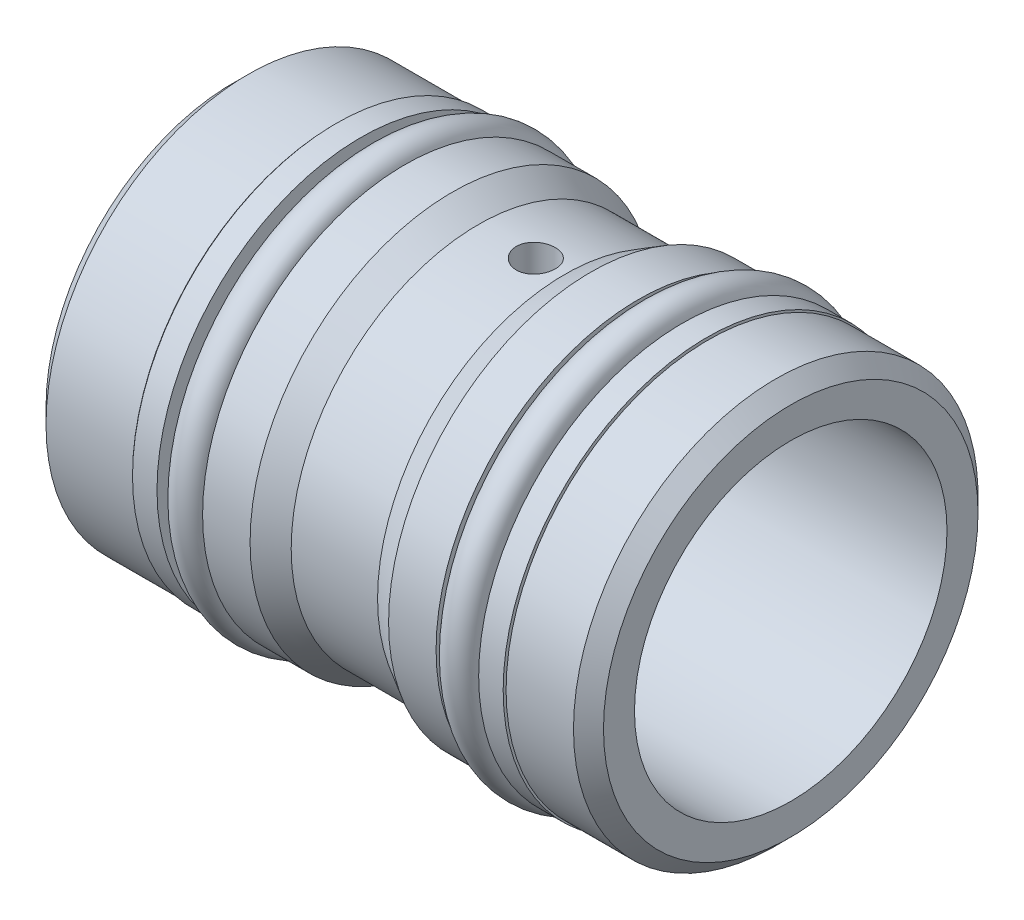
SolidWorks part; units mm, degrees
ref_plane "Front Plane" through (0, 0, 0) normal (0, 0, 1) x (1, 0, 0)
ref_plane "Top Plane" through (0, 0, 0) normal (0, 1, 0) x (1, 0, 0)
ref_plane "Right Plane" through (0, 0, 0) normal (1, 0, 0) x (0, 0, -1)
sketch "Sketch1" plane through (0, 0, 0) normal (0, 0, 1) x (1, 0, 0)
  line L0 (0, 0) -> (0, 45.5562) construction
  line L1 (0, 0) -> (32.8567, 0) construction
  line L2 (-14.16, 4.7625) -> (-14.16, 10.2743)
  line L3 (-14.16, 10.2743) -> (-9, 10.2743)
  line L4 (-9, 10.2743) -> (-9, 9.0043)
  line L5 (-9, 9.0043) -> (-5.444, 9.0043)
  line L6 (-5.444, 9.0043) -> (-5.444, 10.2743)
  line L7 (-5.444, 10.2743) -> (-3.031, 10.2743)
  line L8 (-3.031, 10.2743) -> (-3.031, 9.51)
  line L9 (-3.031, 9.51) -> (4.0048, 9.51)
  line L10 (-14.16, 4.7625) -> (0.0884, 4.7625)
  line L11 (0.0884, 4.7625) -> (0.0884, 7.9375)
  line L12 (0.0884, 7.9375) -> (14.16, 7.9375)
  line L13 (4.0048, 10.2743) -> (4.0048, 9.51)
  line L14 (6.4178, 10.2743) -> (4.0048, 10.2743)
  line L15 (6.4178, 9.0043) -> (6.4178, 10.2743)
  line L16 (9.9738, 9.0043) -> (6.4178, 9.0043)
  line L17 (9.9738, 10.2743) -> (9.9738, 9.0043)
  line L18 (14.16, 10.2743) -> (9.9738, 10.2743)
  line L19 (14.16, 10.2743) -> (14.16, 7.9375)
  dimension "D2" = 3.556
  dimension "D3" = 7.0358
  dimension "D4" = 20.5486
  dimension "D5" = 28.32
  dimension "D6" = 15.875
  dimension "D7" = 14.0716
  dimension "D8" = 19.02
  dimension "D9" = 18.0086
  dimension "D10" = 9.525
  dimension "D11" = 23.16
  dimension "D12" = 2.413
  dimension "D13" = 2.413
revolve "Revolve1" add sketch "Sketch1" angle 360 about L1
fillet "Fillet1" radius 0.381 2 edges at (4.0048, 0, 9.51) (-3.031, 0, 9.51)
chamfer "Chamfer1" distance 0.762 angle 45 2 edges at (14.16, 0, 10.2743) (-14.16, 0, 10.2743)
sketch "Sketch6" plane through (0, 0, 0) normal (0, 0, 1) x (1, 0, 0)
  line L0 (0, 0) -> (49.5791, 0) construction
  line L1 (-14.16, 9.5123) -> (-14.16, -9.5123) construction
  line L2 (-5.444, 9.0043) -> (-9, 9.0043) construction
  line L3 (-8.9276, 9.0043) -> (-7.683, 9.0043)
  line L4 (-8.9276, 9.0043) -> (-8.9276, 10.3505)
  line L5 (-8.9276, 10.3505) -> (-7.683, 10.3505)
  line L6 (-7.683, 9.0043) -> (-7.683, 10.3505)
  line L7 (0.4869, 41.4439) -> (0.4869, -9.3524) construction
  line L8 (-9, -10.2743) -> (-9, 10.2743) construction
  line L9 (9.9738, 9.0043) -> (9.9738, -9.0043) construction
  line L10 (-5.444, 10.2743) -> (-5.444, -10.2743) construction
  line L11 (8.6568, 9.0043) -> (8.6568, 10.3505)
  line L12 (9.9014, 10.3505) -> (8.6568, 10.3505)
  line L13 (9.9014, 9.0043) -> (9.9014, 10.3505)
  line L14 (9.9014, 9.0043) -> (8.6568, 9.0043)
  circle A0 centre (-6.4092, 9.8171) radius 0.889
  circle A1 centre (7.383, 9.8171) radius 0.889
  dimension "D4" = 1.778
  dimension "D5" = 19.6342
  dimension "D6" = 0.9652
  dimension "D1" = 1.2446
  dimension "D2" = 5.2324
  dimension "D3" = 20.701
revolve "Revolve3" add sketch "Sketch6" angle 360 about L0
sketch "Sketch7" plane through (0, 0, 0) normal (0, 1, 0) x (0, 0, -1)
  line L1 (-9.5123, -14.16) -> (9.5123, -14.16) construction
  circle A0 centre (0, -1.21) radius 0.9906
  dimension "D1" = 1.9812
  dimension "D2" = 12.95
extrude "Cut-Extrude1" cut sketch "Sketch7" against normal through all and the other way through all
sketch "Sketch8" plane through (0, 0, 0) normal (0, 0, 1) x (1, 0, 0)
  line L0 (0, 0) -> (15.6047, 0) construction
  line L1 (-3.031, 10.2743) -> (-1.7072, 9.51)
  line L2 (0.2194, 9.51) -> (-2.65, 9.51) construction
  line L3 (-1.7072, 9.51) -> (-3.031, 9.51)
  line L4 (-3.031, -10.2743) -> (-3.031, 10.2743) construction
  line L5 (-3.031, 9.51) -> (-3.031, 10.2743)
  line L6 (4.0048, 10.2743) -> (2.681, 9.51)
  line L7 (4.0048, 10.2743) -> (4.0048, -10.2743) construction
  line L8 (3.6238, 9.51) -> (2.2006, 9.51) construction
  line L9 (2.681, 9.51) -> (4.0048, 9.51)
  line L10 (4.0048, 9.891) -> (4.0048, -9.891) construction
  line L11 (4.0048, 9.51) -> (4.0048, 10.2743)
  line L12 (6.4178, 10.2743) -> (4.0048, 10.2743) construction
  dimension "D1" = 30
  dimension "D2" = 30
revolve "Revolve4" add sketch "Sketch8" angle 360 about L0
